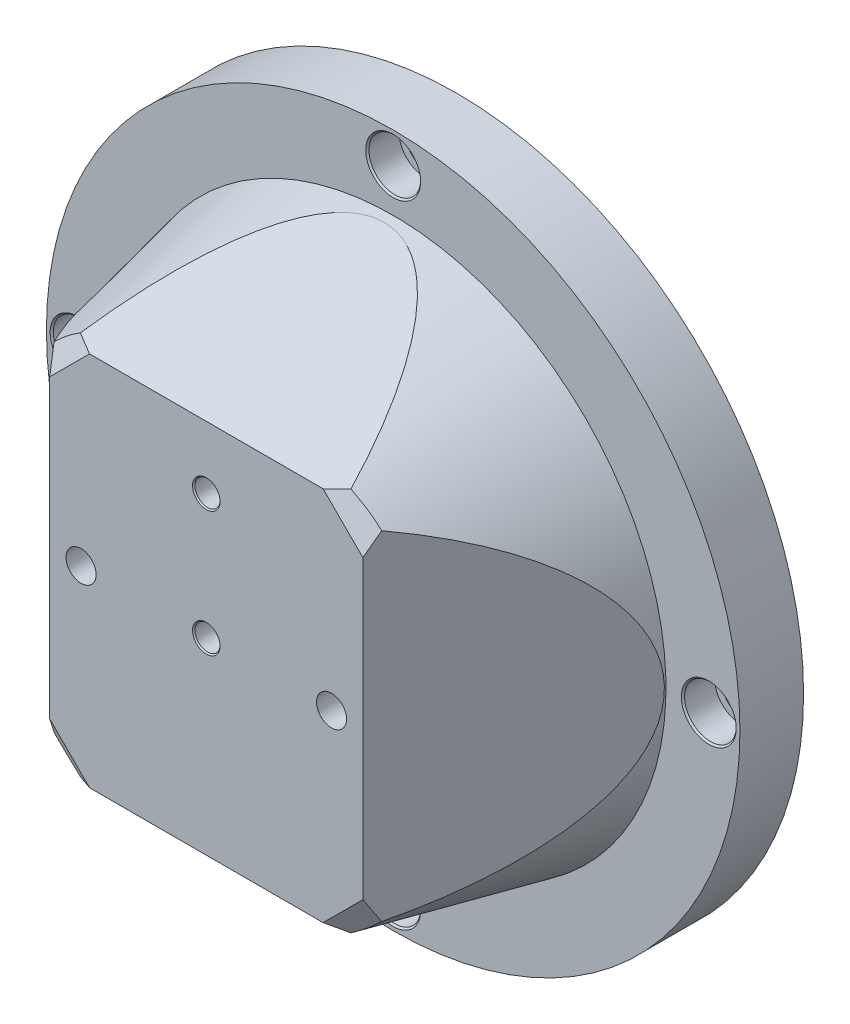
SolidWorks part; units mm, degrees
ref_plane "Front Plane" through (0, 0, 0) normal (0, 0, 1) x (1, 0, 0)
ref_plane "Top Plane" through (0, 0, 0) normal (0, 1, 0) x (1, 0, 0)
ref_plane "Right Plane" through (0, 0, 0) normal (1, 0, 0) x (0, 0, -1)
sketch "Sketch1" plane through (0, 0, 0) normal (0, 0, 1) x (1, 0, 0)
  circle A0 centre (0, 0) radius 114.3
  dimension "D1" = 228.6
extrude "Boss-Extrude1" add sketch "Sketch1" along normal blind 100 draft 12
sketch "Sketch2" plane through (0, 0, 100) normal (0, 0, 1) x (1, 0, 0)
  line L0 (63.5, -63.5) -> (50.8, -76.2)
  line L1 (-50.8, 76.2) -> (50.8, 76.2)
  line L2 (-63.5, 63.5) -> (-63.5, -63.5)
  line L3 (-50.8, -76.2) -> (50.8, -76.2)
  line L4 (63.5, 63.5) -> (63.5, -63.5)
  line L5 (-63.5, 76.2) -> (63.5, -76.2) construction
  line L6 (-63.5, -76.2) -> (63.5, 76.2) construction
  line L7 (-63.5, -63.5) -> (-50.8, -76.2)
  line L8 (-63.5, 63.5) -> (-50.8, 76.2)
  line L9 (50.8, 76.2) -> (63.5, 63.5)
  point P0 (0, 0)
  dimension "D1" = 127
  dimension "D2" = 152.4
sketch "Sketch3" plane through (0, 0, 100) normal (0, 0, 1) x (1, 0, 0)
  line L1 (-62.5, 167.6003) -> (-219.1865, 167.6003)
  line L2 (0, 0) -> (0, 188.1699) construction
  line L3 (-62.5, -132.7696) -> (-219.1865, -132.7696)
  line L4 (-219.1865, 167.6003) -> (-219.1865, -132.7696)
  line L5 (62.5, 150.8607) -> (213.2972, 150.8607)
  line L7 (62.5, -132.7696) -> (213.2972, -132.7696)
  line L8 (213.2972, 150.8607) -> (213.2972, -132.7696)
  line L10 (62.5, -132.7696) -> (62.5, 150.8607)
  line L11 (-62.5, -132.7696) -> (-62.5, 167.6003)
  line L12 (-62.5, 0) -> (-62.5, 188.1699) construction
  line L13 (62.5, 0) -> (62.5, 188.1699) construction
  dimension "D1" = 125
extrude "Cut-Extrude1" cut sketch "Sketch3" against normal blind 101.6 draft 32
sketch "Sketch4" plane through (0, 0, 100) normal (0, 0, 1) x (1, 0, 0)
  line L0 (0, 0) -> (-149.7266, 0) construction
  line L1 (63.5, 75) -> (-100.4119, 75)
  line L2 (63.5, 75) -> (63.5, 234.5886)
  line L3 (63.5, 234.5886) -> (-100.4119, 234.5886)
  line L4 (-100.4119, 75) -> (-100.4119, 234.5886)
  line L5 (63.5, -75) -> (-87.7099, -75)
  line L6 (63.5, -75) -> (63.5, -205.7627)
  line L7 (63.5, -205.7627) -> (-87.7099, -205.7627)
  line L8 (-87.7099, -75) -> (-87.7099, -205.7627)
  line L10 (0, 75) -> (-149.7266, 75) construction
  line L11 (0, -75) -> (-149.7266, -75) construction
  dimension "D1" = 75
  dimension "D2" = 75
extrude "Cut-Extrude2" cut sketch "Sketch4" against normal blind 101.6 draft 25
sketch "Sketch5" plane through (0, 0, 0) normal (0, 0, -1) x (-1, 0, 0)
  circle A0 centre (0, 0) radius 138.43
  dimension "D1" = 276.86
extrude "Boss-Extrude2" add sketch "Sketch5" against normal blind 25.4
sketch "Sketch6" plane through (0, 0, 100) normal (0, 0, 1) x (1, 0, 0)
  line L5 (0, 0) -> (121.6111, 121.6111) construction
  line L11 (-15.8898, -137.515) -> (137.515, 15.8898)
  line L12 (-137.515, -15.8898) -> (15.8898, 137.515)
  line L14 (-60.8126, 60.8126) -> (60.7985, 182.4237) construction
  line L15 (60.8126, -60.8126) -> (182.4237, 60.7985) construction
  circle A0 centre (0, 0) radius 138.43 construction
  arc A1 (-15.8898, -137.515) -> (137.515, 15.8898) centre (0, 0) ccw
  arc A2 (15.8898, 137.515) -> (-137.515, -15.8898) centre (0, 0) ccw
  dimension "D1" = 86.002
  dimension "D2" = 86.002
extrude "Cut-Extrude3" cut sketch "Sketch6" against normal blind 50.8 draft 60
sketch "Sketch7" plane through (0, 0, 100) normal (0, 0, 1) x (1, 0, 0)
  line L0 (0, 0) -> (-121.6111, 121.6111) construction
  line L1 (137.515, -15.8898) -> (-15.8898, 137.515)
  line L2 (15.8898, -137.515) -> (-137.515, 15.8898)
  arc A0 (137.515, -15.8898) -> (-15.8898, 137.515) centre (0, 0) ccw
  arc A1 (-137.515, 15.8898) -> (15.8898, -137.515) centre (0, 0) ccw
extrude "Cut-Extrude4" cut sketch "Sketch7" against normal blind 40.8 draft 60
hole_wizard "CBORE for 1/2 Socket Head Cap Screw1" positions "Sketch9" profile "Sketch8" counterbore size "1/2" standard "ANSI Inch"
sketch "Sketch9" plane through (0, 0, 25.4) normal (0, 0, 1) x (1, 0, 0)
  line L0 (0, 126) -> (0, -126) construction
  circle A0 centre (0, 0) radius 126
  point P0 (126, 0)
  point P2 (-126, 0)
  point P4 (0, 126)
  point P6 (0, -126)
  dimension "D1" = 252
sketch "Sketch8" plane through (126, 0, 25.4) normal (1, 0, 0) x (0, -1, 0)
  line L0 (0, 0) -> (0, 25.4)
  line L1 (6.7462, 24.765) -> (7.3812, 25.4)
  line L2 (6.7462, 24.765) -> (6.7462, 13.335)
  line L3 (6.7462, 13.335) -> (7.3812, 12.7)
  line L4 (7.3812, 12.7) -> (10.3187, 12.7)
  line L5 (10.3187, 12.7) -> (10.3187, 0.635)
  line L6 (10.3187, 0.635) -> (10.9537, 0)
  line L7 (10.9537, 0) -> (0, 0)
  line L8 (-10.3187, 0.635) -> (-10.9537, 0) construction
  line L9 (-6.7462, 13.335) -> (-7.3812, 12.7) construction
  line L11 (0, -6.35) -> (0, 107.95) construction
  line L12 (7.3812, 25.4) -> (0, 25.4)
  line L13 (-6.7462, 24.765) -> (-7.3812, 25.4) construction
  dimension "Thru Hole Dia." = 13.4925
  dimension "Thru Hole Depth" = 25.4
  dimension "C'Bore Dia." = 20.6375
  dimension "C'Bore Depth" = 12.7
  dimension "Near C'Sink Dia." = 21.9075
  dimension "Near C'Sink Angle" = 90
  dimension "Mid C'Sink Dia." = 14.7625
  dimension "Mid C'Sink Angle" = 90
  dimension "Far C'Sink Dia." = 14.7625
  dimension "Far C'Sink Angle" = 90
sketch "Sketch12" plane through (0, 0, 0) normal (0, 0, -1) x (-1, 0, 0)
  circle A0 centre (0, 0) radius 4.7752
  dimension "D1" = 9.5504
extrude "10MM LOCATING PIN" [suppressed] cut sketch "Sketch12" against normal blind 7.62
sketch "Sketch10" plane through (0, 0, 100) normal (0, 0, 1) x (1, 0, 0)
  line L0 (0, 50) -> (0, -50) construction
  line L1 (-50, 0) -> (50, 0) construction
  circle A0 centre (0, 50) radius 5.0063
  circle A1 centre (0, 0) radius 5.0063
  point P3 (0, 0)
  point P6 (0, 0)
  dimension "D3" = 10.0127
  dimension "D1" = 100
  dimension "D2" = 100
sketch "Sketch11" plane through (0, 0, 100) normal (0, 0, 1) x (1, 0, 0)
  circle A0 centre (-50, 0) radius 6.35
  circle A1 centre (50, 0) radius 6.35
  dimension "D1" = 12.7
sketch "Sketch13" [suppressed] plane through (0, 0, 7.62) normal (0, 0, -1) x (-1, 0, 0)
  circle A0 centre (0, 0) radius 2.413
  dimension "D1" = 4.826
extrude "10-32 THREAD" [suppressed] cut sketch "Sketch13" against normal blind 12.7
sketch "Sketch14" [suppressed] plane through (0, 0, 0) normal (0, 0, -1) x (-1, 0, 0)
  circle A0 centre (88.9, 0) radius 3.1877
  circle A2 centre (0, 0) radius 4.7752 construction
  dimension "D1" = 88.9
  dimension "D2" = 6.3754
extrude ".2515 LOCATING PIN" [suppressed] cut sketch "Sketch14" against normal blind 4.318
sketch "Sketch17" [suppressed] plane through (0, 0, 4.318) normal (0, 0, -1) x (-1, 0, 0)
  circle A1 centre (88.9, 0) radius 2.413
  dimension "D1" = 4.826
extrude "Cut-Extrude6" [suppressed] cut sketch "Sketch17" against normal blind 9.652
sketch "Sketch18" plane through (0, 0, 0) normal (0, 0, -1) x (-1, 0, 0)
  line L0 (-181.1319, 0) -> (176.3204, 0)
  line L1 (0, -183.5428) -> (0, 171.18)
  line L2 (0, 0) -> (87.9882, -50.8)
  line L3 (0, 0) -> (73.9229, 42.6794)
  line L4 (0, 0) -> (-73.9229, 42.6794)
  line L5 (0, 0) -> (-73.9229, -42.6794)
  line L6 (-74.4234, 116.722) -> (-73.6889, -117.187) construction
  line L7 (0, 0) -> (-119.4374, -119.4374)
  line L8 (-119.4374, -119.4374) -> (119.4374, -119.4374)
  line L9 (119.4374, -119.4374) -> (119.4374, 119.4374)
  line L10 (119.4374, 119.4374) -> (-119.4374, 119.4374)
  line L11 (-119.4374, 119.4374) -> (-119.4374, -119.4374)
  line L12 (0, -168.91) -> (-152.4, -168.91)
  line L13 (-152.4, -168.91) -> (-152.4, 135.89)
  line L14 (-152.4, 135.89) -> (152.4, 135.89)
  line L15 (152.4, 135.89) -> (152.4, -168.91)
  line L16 (152.4, -168.91) -> (0, -168.91)
  circle A0 centre (0, 0) radius 101.6
  circle A1 centre (0, 0) radius 85.3588
  circle A2 centre (73.9229, 42.6794) radius 6.35
  circle A3 centre (0, 0) radius 168.91
  circle A4 centre (0, -85.3588) radius 6.35
  circle A5 centre (-73.9229, 42.6794) radius 6.35
  circle A6 centre (0, 0) radius 152.4
  circle A7 centre (0, 0) radius 204.1858
  dimension "D1" = 30
  dimension "D5" = 12.7
  dimension "D6" = 12.7
  dimension "D7" = 12.7
  dimension "D8" = 337.82
  dimension "D2" = 30
  dimension "D3" = 30
  dimension "D4" = 30
sketch "Sketch19" [suppressed] plane through (0, -100.8924, 47.0469) normal (0, -0.9063, 0.4226) x (1, 0, 0)
  line L0 (16.3226, -14.8165) -> (-16.3226, -14.8165)
  line L1 (0, -14.8165) -> (0, 58.4273)
  line L2 (50.8, 58.4273) -> (-50.8, 58.4273) construction
  line L3 (-131.0891, 59.372) -> (131.0891, 59.372)
  arc A0 (-16.3226, -14.8165) -> (-131.0891, 59.372) centre (-16.3226, 111.0473) cw
  arc A1 (16.3226, -14.8165) -> (131.0891, 59.372) centre (16.3226, 111.0473) ccw
  ellipse E0 centre (0, 159.3443) end of major axis (0, -14.8165) minor radius 65.5121 (-52.7693, 56.1349) -> (52.7693, 56.1349) ccw construction
sketch "Sketch20" [suppressed] plane through (0, 100.8924, 47.0469) normal (0, 0.9063, 0.4226) x (1, 0, 0)
  line L1 (16.3226, 11.8876) -> (-16.3226, 11.8876)
  line L3 (-0.2556, 11.8876) -> (0, -58.4273)
  line L4 (-50.8, -58.4273) -> (50.8, -58.4273) construction
  ellipse E2 centre (-4.8501, -68.6793) end of major axis (121.0136, -68.6793) minor radius 80.9037 (-16.3226, 11.8876) -> (-129.9668, -59.8774) ccw
  ellipse E3 centre (4.8501, -68.6793) end of major axis (-121.0136, -68.6793) minor radius 80.9037 (129.9668, -59.8774) -> (16.3226, 11.8876) ccw
sketch "Sketch21" [suppressed] plane through (90.608, 0, 56.6182) normal (0.848, 0, 0.5299) x (0.5299, 0, -0.848)
  line L0 (-51.1549, 0) -> (-51.1549, -74.93)
  line L1 (-51.1549, 63.5) -> (-51.1549, -63.5) construction
  line L2 (-51.1549, 0) -> (-51.1549, 74.93)
  arc A0 (-51.1549, 74.93) -> (33.3393, 0) centre (-51.1549, -10.1746) cw
  arc A1 (-51.1549, -74.93) -> (33.3393, 0) centre (-51.1549, 10.1746) ccw
  ellipse E0 centre (-119.1228, 0) end of major axis (33.3393, 0) minor radius 75.9747 (-46.3023, -66.7484) -> (-46.3023, 66.7484) ccw construction
sketch "Sketch22" plane through (89.8888, 0, 56.1688) normal (0.848, 0, 0.5299) x (0.5299, 0, -0.848)
  line L0 (-51.6849, 0) -> (-51.6849, -74.93)
  line L1 (-51.6849, 59.1252) -> (-51.6849, -59.1252) construction
  line L2 (-51.6849, 0) -> (-51.6849, 74.93)
  arc A0 (-51.6849, -74.93) -> (35.6693, 0) centre (-51.6849, 13.4542) cw
  arc A1 (-51.6849, 74.93) -> (35.6693, 0) centre (-51.6849, -13.4542) ccw
  ellipse E0 centre (-117.5187, 0) end of major axis (35.6693, 0) minor radius 76.3364 (-46.2295, -67.5666) -> (-46.2295, 67.5666) ccw construction
sketch "Sketch25" plane through (0, 0, 100) normal (0, 0, 1) x (1, 0, 0)
  line L0 (0, 0) -> (0, 50) construction
  dimension "D1" = 50
sketch "Sketch30" plane through (0, 0, 100) normal (0, 0, 1) x (1, 0, 0)
  circle A0 centre (0, 0) radius 5.0063
  circle A1 centre (0, 50) radius 5.0063
  dimension "D2" = 10.0127
  dimension "D3" = 10.0127
  dimension "D1" = 50
extrude "10MM DOWEL PIN HOLES" [suppressed] cut sketch "Sketch30" against normal blind 7.62
sketch "Sketch31" [suppressed] plane through (0, 0, 100) normal (0, 0, 1) x (1, 0, 0)
  line L0 (-50, 0) -> (50, 0) construction
  line L1 (0, 0) -> (0, 50) construction
  point P8 (-50, 0)
  point P9 (50, 0)
  dimension "D1" = 100
  dimension "D2" = 50
hole_wizard "M12x1.75 Tapped Hole1" positions "Sketch33" profile "Sketch34" tap size "M12x1.75" standard "ANSI Metric"
sketch "Sketch33" plane through (0, 0, 100) normal (0, 0, 1) x (1, 0, 0)
  point P0 (50, 0)
  point P2 (-50, 0)
  dimension "D1" = 50
  dimension "D2" = 100
sketch "Sketch34" plane through (50, 0, 100) normal (1, 0, 0) x (0, -1, 0)
  line L0 (0, 0) -> (0, 32.3144)
  line L1 (0, 32.3144) -> (5.1, 29.25)
  line L2 (5.1, 29.25) -> (5.1, 24)
  line L3 (5.1, 24) -> (6, 24)
  line L4 (6, 24) -> (6, 0)
  line L5 (6, 0) -> (0, 0)
  line L10 (0, 32.3144) -> (-5.1, 29.25) construction
  line L11 (0, -6.35) -> (0, 107.95) construction
  dimension "Tap Drill Dia." = 10.2
  dimension "Tap Drill Depth" = 29.25
  dimension "Thread Major Dia." = 12
  dimension "Thread Depth" = 24
  dimension "Drill Angle" = 118
hole_wizard "Ø10.0mm Dowel Hole1" positions "Sketch36" profile "Sketch37" hole size "Ø10.0" standard "ANSI Metric"
sketch "Sketch36" plane through (0, 0, 0) normal (0, 0, -1) x (-1, 0, 0)
  circle A1 centre (0, 0) radius 100
  point P0 (0, 0)
  point P5 (100, 0)
  dimension "D1" = 200
sketch "Sketch37" plane through (0, 0, 0) normal (1, 0, 0) x (0, 1, 0)
  line L0 (0, 0) -> (0, 8.5)
  line L1 (0, 8.5) -> (5.0127, 8.5)
  line L2 (5.0127, 8.5) -> (5.0127, 0.4873)
  line L3 (5.0127, 0.4873) -> (5.5, 0)
  line L5 (5.5, 0) -> (0, 0)
  line L6 (-5.0127, 0.4873) -> (-5.5, 0) construction
  line L10 (0, 8.5) -> (-5.0127, 8.5) construction
  line L11 (0, -6.35) -> (0, 107.95) construction
  dimension "Hole Dia." = 10.0254
  dimension "Hole Depth" = 8.5
  dimension "Near C'Sink Dia." = 11
  dimension "Near C'Sink Angle" = 90
  dimension "Drill Angle" = 180
hole_wizard "M6x1.0 Tapped Hole1" positions "Sketch39" profile "Sketch38" tap size "M6x1.0" standard "ANSI Metric"
sketch "Sketch39" plane through (0, 0, 0) normal (0, 0, -1) x (-1, 0, 0)
  point P0 (0, 0)
  point P3 (100, 0)
sketch "Sketch38" plane through (0, 0, 0) normal (1, 0, 0) x (0, 1, 0)
  line L0 (0, 0) -> (0, 23.0922)
  line L1 (0, 23.0922) -> (2.5, 21.59)
  line L2 (2.5, 21.59) -> (2.5, 20.574)
  line L3 (2.5, 20.574) -> (3, 20.574)
  line L4 (3, 20.574) -> (3, 0)
  line L5 (3, 0) -> (0, 0)
  line L10 (0, 23.0922) -> (-2.5, 21.59) construction
  line L11 (0, -6.35) -> (0, 107.95) construction
  dimension "Tap Drill Dia." = 5
  dimension "Tap Drill Depth" = 21.59
  dimension "Thread Major Dia." = 6
  dimension "Thread Depth" = 20.574
  dimension "Drill Angle" = 118
sketch "Sketch40" plane through (0, -99.9068, 46.5873) normal (0, -0.9063, 0.4226) x (1, 0, 0)
  line L0 (0, 58.9344) -> (0, -19.5272) construction
  line L2 (-15.2227, 28.9344) -> (15.2227, 28.9344) construction
  line L3 (46.6252, 58.9344) -> (-46.6252, 58.9344) construction
  ellipse E0 centre (0, 156.2673) end of major axis (0, -19.5272) minor radius 66.1266 (-54.0069, 54.8275) -> (54.0069, 54.8275) ccw construction
  text T0 "VP56M  " font "Century Gothic" height 6.35
  point P7 (0, 28.9344)
  dimension "D1" = 30
extrude "LASER ETCH" cut sketch "Sketch40" against normal blind 0.01
hole_wizard "Ø10.0mm Dowel Hole2" positions "Sketch42" profile "Sketch41" hole size "Ø10.0" standard "ANSI Metric"
sketch "Sketch42" plane through (0, 0, 100) normal (0, 0, 1) x (1, 0, 0)
  point P2 (0, 50)
  point P4 (0, 0)
  dimension "D1" = 50
sketch "Sketch41" plane through (0, 50, 100) normal (1, 0, 0) x (0, -1, 0)
  line L0 (0, 0) -> (0, 11.938)
  line L1 (0, 11.938) -> (5.0127, 11.938)
  line L2 (5.0127, 11.938) -> (5.0127, 0.4873)
  line L3 (5.0127, 0.4873) -> (5.5, 0)
  line L5 (5.5, 0) -> (0, 0)
  line L6 (-5.0127, 0.4873) -> (-5.5, 0) construction
  line L10 (0, 11.938) -> (-5.0127, 11.938) construction
  line L11 (0, -6.35) -> (0, 107.95) construction
  dimension "Hole Dia." = 10.0254
  dimension "Hole Depth" = 11.938
  dimension "Near C'Sink Dia." = 11
  dimension "Near C'Sink Angle" = 90
  dimension "Drill Angle" = 180
sketch "Sketch43" plane through (89.8888, 0, 56.1688) normal (0.848, 0, 0.5299) x (0.5299, 0, -0.848)
  line L0 (-51.6849, 0) -> (-51.6849, -73.66)
  line L1 (-51.6849, 59.1252) -> (-51.6849, -59.1252) construction
  line L2 (-51.6849, 0) -> (-51.6849, 73.66)
  ellipse E0 centre (-117.5187, 0) end of major axis (-270.7067, 0) minor radius 76.3364 (-46.2295, -67.5666) -> (-46.2295, 67.5666) ccw construction
  spline S0 degree 2 poles (-51.6849, -73.66) (123.0234, 0) (-51.6849, 73.66) knots 0 0 0 1 1 1
sketch "Sketch44" plane through (-89.8888, 0, 56.1688) normal (-0.848, 0, 0.5299) x (0.5299, 0, 0.848)
  line L0 (51.6849, 0) -> (51.6849, -73.66)
  line L1 (51.6849, -59.1252) -> (51.6849, 59.1252) construction
  line L2 (51.6849, 0) -> (51.6849, 73.66)
  ellipse E0 centre (117.5187, 0) end of major axis (-35.6693, 0) minor radius 76.3364 (46.2295, 67.5666) -> (46.2295, -67.5666) ccw construction
  spline S0 degree 2 poles (51.6849, 73.66) (-123.0234, 0) (51.6849, -73.66) knots 0 0 0 1 1 1
sketch "Sketch45" plane through (0, 99.9068, 46.5873) normal (0, 0.9063, 0.4226) x (1, 0, 0)
  line L0 (0, -58.9344) -> (-73.66, -58.9344)
  line L1 (-46.6252, -58.9344) -> (46.6252, -58.9344) construction
  line L2 (0, -58.9344) -> (73.66, -58.9344)
  ellipse E0 centre (0, -156.2673) end of major axis (0, 19.5272) minor radius 66.1266 (54.0069, -54.8275) -> (-54.0069, -54.8275) ccw construction
  spline S0 degree 2 poles (73.66, -58.9344) (0, 97.9889) (-73.66, -58.9344) knots 0 0 0 1 1 1
sketch "Sketch46" plane through (0, -99.9068, 46.5873) normal (0, -0.9063, 0.4226) x (1, 0, 0)
  line L0 (0, 58.9344) -> (73.66, 58.9344)
  line L1 (46.6252, 58.9344) -> (-46.6252, 58.9344) construction
  line L2 (0, 58.9344) -> (-73.66, 58.9344)
  ellipse E0 centre (0, 156.2673) end of major axis (0, 332.0618) minor radius 66.1266 (-54.0069, 54.8275) -> (54.0069, 54.8275) ccw construction
  spline S0 degree 2 poles (-73.66, 58.9344) (0, -97.9889) (73.66, 58.9344) knots 0 0 0 1 1 1
chamfer "Chamfer1" distance 0.508 angle 45 2 edges at (-97, 0, 8.5) (3, 0, 8.5)
sketch "Sketch47" plane through (-89.8888, 0, 56.1688) normal (-0.848, 0, 0.5299) x (0.5299, 0, 0.848)
  line L0 (93.6441, 0) -> (-35.6693, 0)
  line L1 (46.2295, 67.5666) -> (46.2295, -67.5666)
  line L2 (51.6849, 0) -> (51.6849, 73.66)
  line L3 (51.6849, -59.1252) -> (51.6849, 59.1252) construction
  line L4 (51.6849, 0) -> (51.6849, -73.66)
  ellipse E0 centre (117.5187, 0) end of major axis (-35.6693, 0) minor radius 76.3364 (46.2295, 67.5666) -> (46.2295, -67.5666) ccw construction
  ellipse E1 centre (117.5187, 0) end of major axis (-35.6693, 0) minor radius 76.3364 (46.2295, 67.5666) -> (46.2295, -67.5666) ccw
  spline S0 degree 2 poles (51.6849, 73.66) (-33.4051, 54.0051) (-35.6693, 0) knots 0 0 0 0.854426 0.854426 0.854426
  spline S1 degree 2 poles (51.6849, -73.66) (-33.4051, -54.0051) (-35.6693, 0) knots 0 0 0 0.854426 0.854426 0.854426
  dimension "D1" = 73.66
